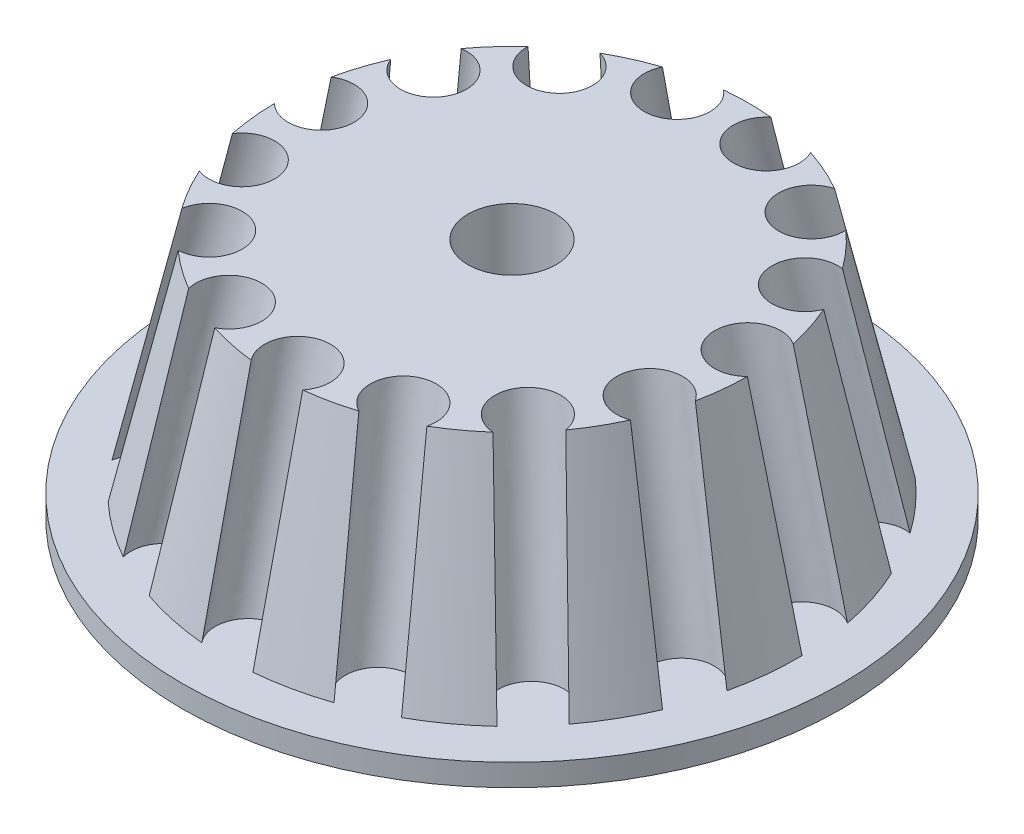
SolidWorks part; units mm, degrees
ref_plane "Front Plane" through (0, 0, 0) normal (0, 0, 1) x (1, 0, 0)
ref_plane "Top Plane" through (0, 0, 0) normal (0, 1, 0) x (1, 0, 0)
ref_plane "Right Plane" through (0, 0, 0) normal (1, 0, 0) x (0, 0, -1)
sketch "Sketch1" plane through (0, 0, 0) normal (0, 1, 0) x (1, 0, 0)
  circle A0 centre (0, 0) radius 13
  dimension "D1" = 26
extrude "Boss-Extrude1" add sketch "Sketch1" along normal blind 10
sketch "Sketch2" plane through (0, 0, 0) normal (1, 0, 0) x (0, 0, -1)
  line L0 (-13, 0) -> (-10.7574, 10)
  line L1 (13, 10) -> (-13, 10) construction
  line L2 (-10.7574, 10) -> (-13, 10)
  line L3 (-13, 10) -> (-13, 0)
  line L4 (0, 0) -> (0, 50000) construction
  line L5 (-13, 0) -> (13, 0) construction
  point P11 (0, 0)
  dimension "D1" = 12.64
revolve "Cut-Revolve1" cut sketch "Sketch2" angle 360 about L4
sketch "Sketch3" plane through (0, 0, 0) normal (0, -1, 0) x (-1, 0, 0)
  circle A0 centre (0, 0) radius 15
  dimension "D1" = 30
extrude "Boss-Extrude2" add sketch "Sketch3" along normal blind 1
sketch "Sketch4" plane through (0, -1, 0) normal (0, -1, 0) x (1, 0, 0)
  line L0 (1.145, -1.6398) -> (1.145, 1.6398)
  line L1 (-1.145, -1.6398) -> (-1.145, 1.6398)
  line L2 (0, 0) -> (35355.3391, 35355.3391) construction
  line L3 (0.8543, 0) -> (50000.8543, 0) construction
  line L4 (-1.6398, 1.145) -> (1.6398, 1.145)
  line L5 (-1.6398, -1.145) -> (1.6398, -1.145)
  circle A0 centre (0, 0) radius 2
  dimension "D1" = 4
  dimension "D2" = 2.29
  dimension "D3" = 45
sketch "Sketch5" plane through (0, 10, 0) normal (0, 1, 0) x (1, 0, 0)
  line L0 (-1.9033, 1) -> (1.9033, 1)
  circle A0 centre (0, 0) radius 2.15
  dimension "D1" = 4.3
  dimension "D2" = 1
extrude "Cut-Extrude2" [suppressed] cut sketch "Sketch5" against normal through all contours L0 A0
ref_plane "Plane1" through (0, 2.7758, 12.3775) normal (0, 0.2188, 0.9758) x (1, 0, 0)
sketch "Sketch7" plane through (0, 10, 0) normal (0, 1, 0) x (1, 0, 0)
  circle A0 centre (0, -9.7574) radius 1.5
  circle A1 centre (0, 0) radius 9.7574 construction
  circle A2 centre (0, 0) radius 10.7574 construction
  dimension "D1" = 3
  dimension "D2" = 1
sketch "Sketch8" plane through (0, 0, 0) normal (0, 1, 0) x (1, 0, 0)
  circle A0 centre (0, -12) radius 1.5
  circle A1 centre (0, 0) radius 12 construction
  circle A2 centre (0, 0) radius 13 construction
  circle A4 centre (0, -9.7574) radius 1.5 construction
  dimension "D1" = 1
loft "Cut-Loft1" cut profiles "Sketch7", "Sketch8"
pattern_circular "CirPattern1" count 15 over 360 of "Cut-Loft1"
extrude "Cut-Extrude3" cut sketch "Sketch4" against normal up to surface (11 mm away) contours L5 A0 L4 L0 | L4 A0 L0 | L0 A0 L1 L4 | L1 L5 L0 L4 | L0 A0 L5 | L1 A0 L0 L5 | L5 A0 L1 | L4 A0 L5 L1 | L1 A0 L4
